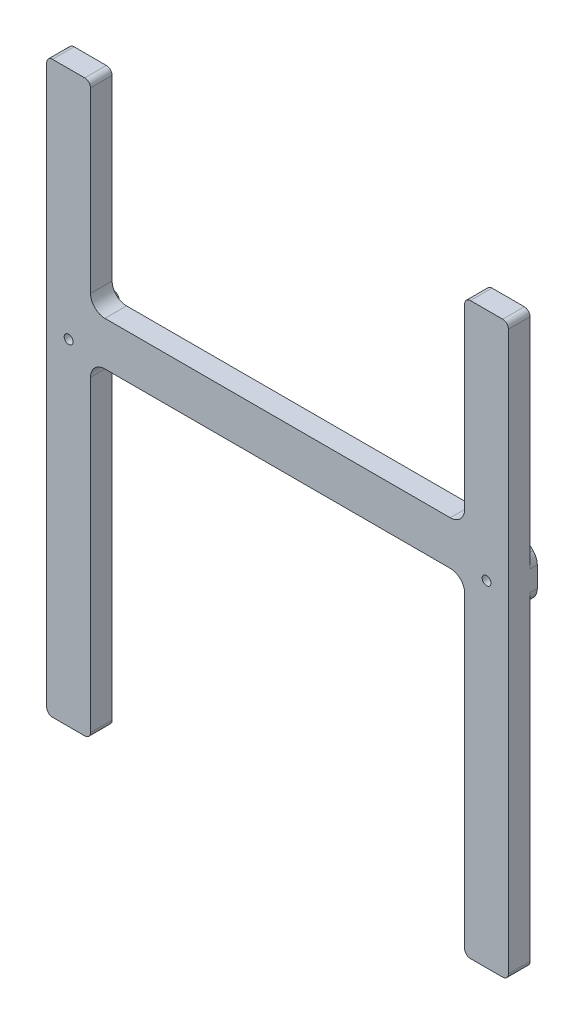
SolidWorks part; units mm, degrees
ref_plane "Front" through (0, 0, 0) normal (0, 0, 1) x (1, 0, 0)
ref_plane "Top" through (0, 0, 0) normal (0, 1, 0) x (1, 0, 0)
ref_plane "Right" through (0, 0, 0) normal (1, 0, 0) x (0, 0, -1)
sketch "Sketch1" plane through (0, 0, 0) normal (0, 0, 1) x (1, 0, 0)
  line L0 (-92.075, -9.525) -> (92.075, -9.525) construction
  line L12 (90.17, 0) -> (-90.17, 0)
  line L13 (-90.17, 0) -> (-95.25, -5.08)
  line L14 (-95.25, -5.08) -> (-95.25, -13.97)
  line L15 (-95.25, -13.97) -> (-90.17, -19.05)
  line L16 (-90.17, -19.05) -> (-88.9, -19.05)
  line L17 (-88.9, -19.05) -> (-88.9, -6.35)
  line L18 (-88.9, -6.35) -> (88.9, -6.35)
  line L19 (88.9, -6.35) -> (88.9, -19.05)
  line L20 (88.9, -19.05) -> (90.17, -19.05)
  line L21 (90.17, -19.05) -> (95.25, -13.97)
  line L22 (95.25, -13.97) -> (95.25, -5.08)
  line L23 (95.25, -5.08) -> (90.17, 0)
  line L24 (90.17, 0) -> (-90.17, 0)
  line L25 (-90.17, 0) -> (-95.25, -5.08)
  line L26 (-95.25, -5.08) -> (-95.25, -13.97)
  line L27 (-95.25, -13.97) -> (-90.17, -19.05)
  line L28 (-90.17, -19.05) -> (-88.9, -19.05)
  line L29 (-88.9, -19.05) -> (-88.9, -6.35)
  line L30 (-88.9, -6.35) -> (88.9, -6.35)
  line L31 (88.9, -6.35) -> (88.9, -19.05)
  line L32 (88.9, -19.05) -> (90.17, -19.05)
  line L33 (90.17, -19.05) -> (95.25, -13.97)
  line L34 (95.25, -13.97) -> (95.25, -5.08)
  line L35 (95.25, -5.08) -> (90.17, 0)
  point P2 (-92.075, -9.525)
  point P4 (92.075, -9.525)
  point P10 (0, -9.525)
  point P12 (0, -31.75)
  point P14 (0, 0)
  dimension "D2" = 9.525
  dimension "D3" = 184.15
  dimension "D4" = 31.75
  dimension "D1" = 0
sketch "Sketch2" plane through (0, 0, 0) normal (0, 0, 1) x (1, 0, 0)
  line L12 (92.8529, 6.477) -> (-92.8529, 6.477)
  line L13 (-92.8529, 6.477) -> (-101.727, -2.3971)
  line L14 (-101.727, -2.3971) -> (-101.727, -16.6529)
  line L15 (-101.727, -16.6529) -> (-92.8529, -25.527)
  line L16 (-92.8529, -25.527) -> (-82.423, -25.527)
  line L17 (-82.423, -25.527) -> (-82.423, -12.827)
  line L18 (-82.423, -12.827) -> (82.423, -12.827)
  line L19 (82.423, -12.827) -> (82.423, -25.527)
  line L20 (82.423, -25.527) -> (92.8529, -25.527)
  line L21 (92.8529, -25.527) -> (101.727, -16.6529)
  line L22 (101.727, -16.6529) -> (101.727, -2.3971)
  line L23 (101.727, -2.3971) -> (92.8529, 6.477)
  line L24 (90.2226, 0.127) -> (-90.2226, 0.127)
  line L25 (-90.2226, 0.127) -> (-95.377, -5.0274)
  line L26 (-95.377, -5.0274) -> (-95.377, -14.0226)
  line L27 (-95.377, -14.0226) -> (-90.2226, -19.177)
  line L28 (-90.2226, -19.177) -> (-88.773, -19.177)
  line L29 (-88.773, -19.177) -> (-88.773, -6.477)
  line L30 (-88.773, -6.477) -> (88.773, -6.477)
  line L31 (88.773, -6.477) -> (88.773, -19.177)
  line L32 (88.773, -19.177) -> (90.2226, -19.177)
  line L33 (90.2226, -19.177) -> (95.377, -14.0226)
  line L34 (95.377, -14.0226) -> (95.377, -5.0274)
  line L35 (95.377, -5.0274) -> (90.2226, 0.127)
  line L36 (90.2226, 0.127) -> (-90.2226, 0.127)
  line L37 (-90.2226, 0.127) -> (-95.377, -5.0274)
  line L38 (-95.377, -5.0274) -> (-95.377, -14.0226)
  line L39 (-95.377, -14.0226) -> (-90.2226, -19.177)
  line L40 (-90.2226, -19.177) -> (-88.773, -19.177)
  line L41 (-88.773, -19.177) -> (-88.773, -6.477)
  line L42 (-88.773, -6.477) -> (88.773, -6.477)
  line L43 (88.773, -6.477) -> (88.773, -19.177)
  line L44 (88.773, -19.177) -> (90.2226, -19.177)
  line L45 (90.2226, -19.177) -> (95.377, -14.0226)
  line L46 (95.377, -14.0226) -> (95.377, -5.0274)
  line L47 (95.377, -5.0274) -> (90.2226, 0.127)
  dimension "D1" = 0.127
  dimension "D2" = 6.35
extrude "Boss-Extrude1" add sketch "Sketch2" against normal blind 3.175
sketch "Sketch3" plane through (0, 0, 0) normal (0, 0, 1) x (1, 0, 0)
  line L0 (92.8529, 6.477) -> (-92.8529, 6.477) construction
  line L1 (-92.8529, 6.477) -> (-101.727, -2.3971) construction
  line L2 (-101.727, -2.3971) -> (-101.727, -16.6529) construction
  line L3 (-101.727, -16.6529) -> (-92.8529, -25.527) construction
  line L4 (-92.8529, -25.527) -> (-82.423, -25.527) construction
  line L5 (-82.423, -25.527) -> (-82.423, -12.827) construction
  line L6 (-82.423, -12.827) -> (82.423, -12.827) construction
  line L7 (82.423, -12.827) -> (82.423, -25.527) construction
  line L8 (82.423, -25.527) -> (92.8529, -25.527) construction
  line L9 (92.8529, -25.527) -> (101.727, -16.6529) construction
  line L10 (101.727, -16.6529) -> (101.727, -2.3971) construction
  line L11 (101.727, -2.3971) -> (92.8529, 6.477) construction
  line L12 (92.8529, 6.477) -> (-92.8529, 6.477)
  line L13 (-92.8529, 6.477) -> (-101.727, -2.3971)
  line L14 (-101.727, -2.3971) -> (-101.727, -16.6529)
  line L15 (-101.727, -16.6529) -> (-92.8529, -25.527)
  line L16 (-92.8529, -25.527) -> (-82.423, -25.527)
  line L17 (-82.423, -25.527) -> (-82.423, -12.827)
  line L18 (-82.423, -12.827) -> (82.423, -12.827)
  line L19 (82.423, -12.827) -> (82.423, -25.527)
  line L20 (82.423, -25.527) -> (92.8529, -25.527)
  line L21 (92.8529, -25.527) -> (101.727, -16.6529)
  line L22 (101.727, -16.6529) -> (101.727, -2.3971)
  line L23 (101.727, -2.3971) -> (92.8529, 6.477)
extrude "Boss-Extrude2" add sketch "Sketch3" along normal blind 9.525
sketch "Sketch4" plane through (0, 0, 0) normal (0, 0, 1) x (1, 0, 0)
  line L1 (-101.727, 93.7895) -> (-82.423, 93.7895)
  line L2 (-101.727, 93.7895) -> (-101.727, -157.2895)
  line L3 (-101.727, -157.2895) -> (-82.423, -157.2895)
  line L4 (-82.423, 93.7895) -> (-82.423, -157.2895)
  line L5 (82.423, 93.7895) -> (101.727, 93.7895)
  line L6 (82.423, 93.7895) -> (82.423, -157.2895)
  line L7 (82.423, -157.2895) -> (101.727, -157.2895)
  line L8 (101.727, 93.7895) -> (101.727, -157.2895)
  point P8 (-82.423, -31.75)
  dimension "D1" = 251.079
extrude "Boss-Extrude3" add sketch "Sketch4" along normal blind 9.525
sketch "Sketch5" plane through (0, 0, 0) normal (0, 0, 1) x (1, 0, 0)
  line L1 (-82.55, 25.4) -> (82.55, 25.4)
  line L2 (-82.55, 25.4) -> (-82.55, -25.4)
  line L3 (-82.55, -25.4) -> (82.55, -25.4)
  line L4 (82.55, 25.4) -> (82.55, -25.4)
  point P4 (0, 25.4)
  point P6 (-82.55, 0)
  dimension "D1" = 165.1
  dimension "D2" = 50.8
extrude "Cut-Extrude1" cut sketch "Sketch5" against normal blind 9.525
fillet "Fillet1" radius 6.35 24 edges at (-82.423, 6.477, 4.7625) (82.423, 6.477, 4.7625) (82.423, -25.4635, -3.175) (82.4865, -25.4, -3.175) (-82.4865, -25.4, -3.175) (-82.423, -12.827, 4.7625) (82.423, -12.827, 4.7625) (-82.423, -25.4, -1.5875) (82.423, -25.4, -1.5875) (-82.55, -25.4, -1.5875) (101.727, -2.3971, -1.5875) (82.4865, -25.4, 0) (101.727, -16.6529, -1.5875) (-82.4865, -25.4, 0) (92.8529, -25.527, -1.5875) (82.423, -25.527, -1.5875) (82.55, -25.4, -1.5875) (-82.423, -25.527, -1.5875) (-92.8529, -25.527, -1.5875) (-101.727, -16.6529, -1.5875) (-101.727, -2.3971, -1.5875) (-92.8529, 6.477, -1.5875) (92.8529, 6.477, -1.5875) (-82.423, -25.4635, -3.175)
fillet "Fillet2" radius 2.54 8 edges at (82.55, -6.477, -1.5875) (82.55, 6.477, -1.5875) (-82.55, -6.477, -1.5875) (-82.55, 6.477, -1.5875) (-82.55, 0.127, -1.5875) (82.55, 0.127, -1.5875) (88.773, -6.477, -1.5875) (-88.773, -6.477, -1.5875)
hole_wizard "#6 Clearance Hole1" positions "Sketch6" profile "Sketch7" hole size "#6" standard "ANSI Inch"
sketch "Sketch6" plane through (0, 0, 0) normal (0, 0, 1) x (1, 0, 0)
  point P0 (-92.075, -9.525)
  point P3 (92.075, -9.525)
sketch "Sketch7" plane through (-92.075, -9.525, 0) normal (1, 0, 0) x (0, 1, 0)
  line L0 (0, 0) -> (0, 10.6914)
  line L1 (0, 10.6914) -> (2.1526, 9.398)
  line L2 (2.1526, 9.398) -> (2.1526, 0)
  line L5 (2.1526, 0) -> (0, 0)
  line L10 (0, 10.6914) -> (-2.1527, 9.398) construction
  line L11 (0, -6.35) -> (0, 107.95) construction
  dimension "Hole Dia." = 4.3053
  dimension "Hole Depth" = 9.398
  dimension "Drill Angle" = 118
fillet "Fillet3" radius 2.54 8 edges at (-101.727, 93.7895, 4.7625) (-82.423, 93.7895, 4.7625) (82.423, 93.7895, 4.7625) (101.727, 93.7895, 4.7625) (-101.727, -157.2895, 4.7625) (-82.423, -157.2895, 4.7625) (101.727, -157.2895, 4.7625) (82.423, -157.2895, 4.7625)
